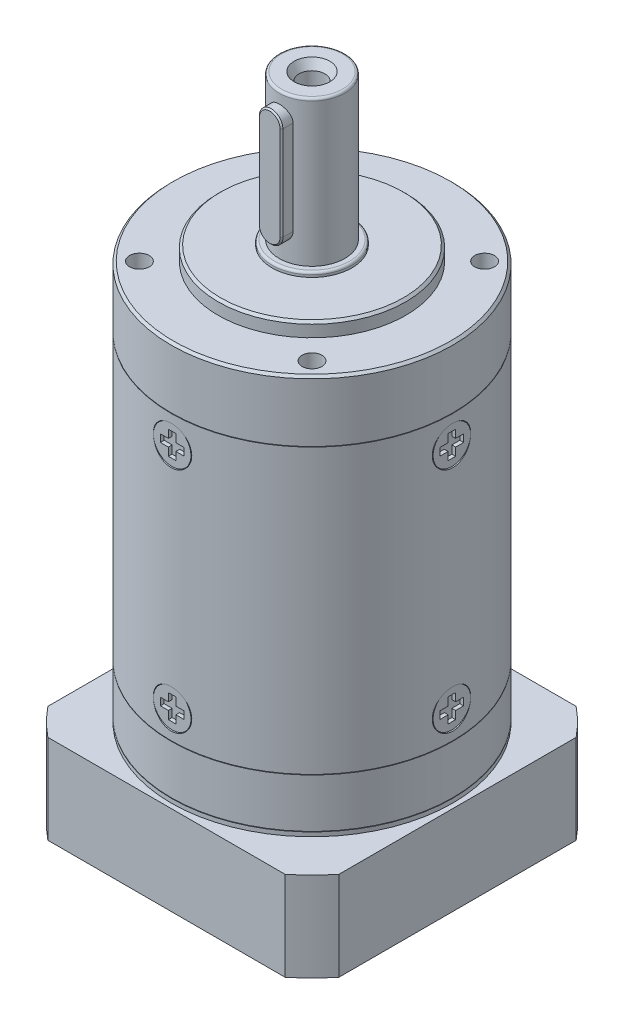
SolidWorks part; units mm, degrees
ref_plane "前视基准面" through (0, 0, 0) normal (0, 0, 1) x (1, 0, 0)
ref_plane "上视基准面" through (0, 0, 0) normal (0, 1, 0) x (1, 0, 0)
ref_plane "右视基准面" through (0, 0, 0) normal (1, 0, 0) x (0, 0, -1)
sketch "草图1" plane through (0, 0, 0) normal (0, 1, 0) x (1, 0, 0)
  circle A0 centre (0, 0) radius 20
extrude "凸台-拉伸1" add sketch "草图1" along normal blind 3
sketch "草图2" plane through (0, 0, 0) normal (0, -1, 0) x (1, 0, 0)
  circle A0 centre (0, 0) radius 30
extrude "凸台-拉伸2" add sketch "草图2" along normal blind 13
ref_plane "基准面1" through (0, -13.1, 0) normal (0, -1, 0) x (1, 0, 0)
sketch "草图3" plane through (0, -13.1, 0) normal (0, -1, 0) x (1, 0, 0)
  circle A0 centre (0, 0) radius 30
extrude "凸台-拉伸3" add sketch "草图3" along normal blind 60.4 separate body
ref_plane "基准面2" through (0, -73.6, 0) normal (0, -1, 0) x (1, 0, 0)
sketch "草图4" plane through (0, -73.6, 0) normal (0, -1, 0) x (1, 0, 0)
  circle A0 centre (0, 0) radius 30
extrude "凸台-拉伸4" add sketch "草图4" along normal blind 10.4 separate body
ref_plane "基准面3" through (0, -84.1, 0) normal (0, -1, 0) x (1, 0, 0)
sketch "草图5" plane through (0, -84.1, 0) normal (0, -1, 0) x (1, 0, 0)
  circle A0 centre (0, 0) radius 30
extrude "凸台-拉伸5" add sketch "草图5" along normal blind 0.9 separate body
sketch "草图6" plane through (0, -85, 0) normal (0, -1, 0) x (1, 0, 0)
  line L1 (-25.2784, 31) -> (25.2784, 31)
  line L2 (-31, 25.2784) -> (-31, -25.2784)
  line L3 (-25.2784, -31) -> (25.2784, -31)
  line L4 (31, 25.2784) -> (31, -25.2784)
  arc A0 (-25.2784, 31) -> (-31, 25.2784) centre (0, 0) ccw
  arc A1 (-31, -25.2784) -> (-25.2784, -31) centre (0, 0) ccw
  arc A2 (25.2784, -31) -> (31, -25.2784) centre (0, 0) ccw
  arc A3 (31, 25.2784) -> (25.2784, 31) centre (0, 0) ccw
  dimension "D1" = 31
  dimension "D3" = 31
extrude "凸台-拉伸6" add sketch "草图6" along normal blind 19
sketch "草图7" plane through (0, -104, 0) normal (0, -1, 0) x (1, 0, 0)
  circle A0 centre (0, 0) radius 25
extrude "切除-拉伸1" cut sketch "草图7" against normal blind 5
sketch "草图8" plane through (0, -99, 0) normal (0, -1, 0) x (1, 0, 0)
  circle A0 centre (0, 0) radius 17.5
extrude "切除-拉伸2" cut sketch "草图8" against normal blind 19
ref_plane "基准面4" through (0, -97, 0) normal (0, -1, 0) x (1, 0, 0)
sketch "草图9" plane through (0, -97, 0) normal (0, -1, 0) x (1, 0, 0)
  circle A0 centre (0, 0) radius 16
extrude "凸台-拉伸7" add sketch "草图9" against normal up to surface (17 mm away)
chamfer "倒角1" distance 1 angle 45 1 edges at (0, -97, -16)
sketch "草图10" plane through (0, -104, 0) normal (0, -1, 0) x (1, 0, 0)
  circle A0 centre (0, 0) radius 7
extrude "切除-拉伸3" cut sketch "草图10" against normal blind 32
sketch "草图11" plane through (0, -97, 0) normal (0, -1, 0) x (1, 0, 0)
  line L1 (-16.7216, 0.5) -> (16.9728, 0.5)
  line L2 (-16.7216, 0.5) -> (-16.7216, -0.5)
  line L3 (-16.7216, -0.5) -> (16.9728, -0.5)
  line L4 (16.9728, 0.5) -> (16.9728, -0.5)
  dimension "D1" = 0.5
  dimension "D2" = 1
extrude "切除-拉伸4" cut sketch "草图11" against normal up to surface (17 mm away)
sketch "草图12" plane through (0, -104, 0) normal (0, -1, 0) x (1, 0, 0)
  line L0 (0, 0) -> (0, 25.5) construction
  line L1 (0, 0) -> (-12.75, 22.0836) construction
  circle A0 centre (0, 0) radius 25.5 construction
  circle A1 centre (-12.75, 22.0836) radius 4
  dimension "D1" = 30
extrude "切除-拉伸5" cut sketch "草图12" against normal blind 12
pattern_circular "阵列(圆周)1" count 4 over 360 about axis through (0, 0, 0) along (0, 1, 0) of "切除-拉伸5"
chamfer "倒角3" distance 0.5 angle 45 1 edges at (0, 3, 20)
sketch "草图13" plane through (0, -104, 0) normal (0, -1, 0) x (1, 0, 0)
  line L0 (0, 0) -> (-24.7487, -24.7487)
  circle A0 centre (0, 0) radius 35
hole_wizard "M4 螺纹孔1" positions "3D草图1" profile "草图14" tap size "M4" standard "GB"
sketch3d "3D草图1"
  point P0 (-24.7487, -104, -24.7487)
sketch "草图14" plane through (-24.7487, -104, -24.7487) normal (1, 0, 0) x (0, 0, -1)
  line L0 (0, 0) -> (0, 14.4914)
  line L1 (0, 14.4914) -> (1.65, 13.5)
  line L2 (1.65, 13.5) -> (1.65, 0)
  line L5 (1.65, 0) -> (0, 0)
  line L10 (0, 14.4914) -> (-1.65, 13.5) construction
  line L11 (0, -6.35) -> (0, 107.95) construction
  dimension "螺纹孔钻头直径" = 3.3
  dimension "螺纹孔钻头深度" = 13.5
  dimension "导头角度" = 118
pattern_circular "阵列(圆周)2" count 4 over 360 about axis through (0, 0, 0) along (0, 1, 0) of "M4 螺纹孔1"
sketch "草图15" plane through (0, 3, 0) normal (0, 1, 0) x (1, 0, 0)
  circle A0 centre (0, 0) radius 8.5
extrude "凸台-拉伸8" add sketch "草图15" along normal blind 1
sketch "草图16" plane through (0, 4, 0) normal (0, 1, 0) x (1, 0, 0)
  circle A0 centre (0, 0) radius 7
extrude "凸台-拉伸9" add sketch "草图16" along normal blind 31
fillet "圆角1" radius 0.5 1 edges at (0, 4, 8.5)
fillet "圆角2" radius 0.5 1 edges at (0, 35, 7)
ref_plane "基准面5" through (0, 0, 30) normal (0, 0, 1) x (1, 0, 0)
ref_plane "基准面6" through (0, 0, 29) normal (0, 0, 1) x (1, 0, 0)
sketch "草图19" plane through (0, 0, 29) normal (0, 0, 1) x (1, 0, 0)
  line L0 (-30, -13) -> (30, -13) construction
  line L1 (30, -73.6) -> (-30, -73.6) construction
  circle A0 centre (0, -19) radius 4.1
  circle A1 centre (0, -67.6) radius 4.1
  dimension "D1" = 6
  dimension "D2" = 6
extrude "切除-拉伸6" cut sketch "草图19" along normal blind 31
pattern_circular "阵列(圆周)5" count 4 over 360 about axis through (0, 0, 0) along (0, 1, 0) of "切除-拉伸6"
sketch "草图20" plane through (0, 0, 29) normal (0, 0, 1) x (1, 0, 0)
  line L0 (0.8, -19.8) -> (0.8, -21.5)
  line L1 (-0.8, -16.5) -> (0.8, -16.5)
  line L2 (-0.8, -16.5) -> (-0.8, -18.2)
  line L3 (-0.8, -21.5) -> (0.8, -21.5)
  line L4 (0.8, -16.5) -> (0.8, -18.2)
  line L5 (-2.5, -18.2) -> (-0.8, -18.2)
  line L6 (-2.5, -18.2) -> (-2.5, -19.8)
  line L7 (-2.5, -19.8) -> (-0.8, -19.8)
  line L8 (2.5, -18.2) -> (2.5, -19.8)
  line L9 (-0.8, -19.8) -> (-0.8, -21.5)
  line L10 (0.8, -18.2) -> (2.5, -18.2)
  line L11 (0.8, -19.8) -> (2.5, -19.8)
  line L12 (0.8, -68.4) -> (0.8, -70.1)
  line L13 (-2.5, -66.8) -> (-0.8, -66.8)
  line L14 (-2.5, -66.8) -> (-2.5, -68.4)
  line L15 (-2.5, -68.4) -> (-0.8, -68.4)
  line L16 (2.5, -66.8) -> (2.5, -68.4)
  line L17 (-0.8, -65.1) -> (0.8, -65.1)
  line L18 (-0.8, -65.1) -> (-0.8, -66.8)
  line L19 (-0.8, -70.1) -> (0.8, -70.1)
  line L20 (0.8, -65.1) -> (0.8, -66.8)
  line L21 (-0.8, -68.4) -> (-0.8, -70.1)
  line L22 (0.8, -66.8) -> (2.5, -66.8)
  line L23 (0.8, -68.4) -> (2.5, -68.4)
  circle A0 centre (0, -19) radius 4
  circle A1 centre (0, -67.6) radius 4
  dimension "D1" = 0.8
  dimension "D9" = 0.8
  dimension "D2" = 1.6
  dimension "D3" = 0.8
  dimension "D4" = 1.6
  dimension "D5" = 2.5
  dimension "D6" = 5
  dimension "D7" = 2.5
  dimension "D8" = 5
  dimension "D10" = 1.6
  dimension "D11" = 0.8
  dimension "D12" = 1.6
  dimension "D13" = 2.5
  dimension "D14" = 5
  dimension "D15" = 2.5
  dimension "D16" = 5
extrude "凸台-拉伸10" add sketch "草图20" along normal blind 0.8
pattern_circular "阵列(圆周)21" count 4 over 360 about axis through (0, 0, 0) along (0, 1, 0) of "凸台-拉伸10"
sketch "草图21" plane through (0, -92, 0) normal (0, -1, 0) x (1, 0, 0)
  line L1 (-11.8663, 23.5733) -> (-13.5983, 23.5938)
  line L2 (-13.5983, 23.5938) -> (-14.4819, 22.1041)
  line L3 (-14.4819, 22.1041) -> (-13.6337, 20.594)
  line L4 (-13.6337, 20.594) -> (-11.9017, 20.5735)
  line L5 (-11.9017, 20.5735) -> (-11.0181, 22.0632)
  line L6 (-11.0181, 22.0632) -> (-11.8663, 23.5733)
  circle A0 centre (-12.75, 22.0836) radius 3.5
  circle A1 centre (-12.75, 22.0836) radius 1.5 construction
  dimension "D1" = 3
extrude "凸台-拉伸11" add sketch "草图21" along normal blind 4
pattern_circular "阵列(圆周)22" count 4 over 360 about axis through (0, 0, 0) along (0, 1, 0) of "凸台-拉伸11"
sketch "草图22" plane through (0, 0, 0) normal (0, 0, 1) x (1, 0, 0)
  line L0 (6.5, 35) -> (-6.5, 35) construction
  line L1 (-2.5, 30) -> (-2.5, 10)
  line L2 (2.5, 30) -> (2.5, 10)
  arc A0 (2.5, 30) -> (-2.5, 30) centre (0, 30) ccw
  arc A1 (-2.5, 10) -> (2.5, 10) centre (0, 10) ccw
  dimension "D1" = 5
  dimension "D2" = 20
extrude "凸台-拉伸12" add sketch "草图22" along normal blind 9
chamfer "倒角4" distance 0.3 angle 45 4 edges at (-2.5, 20, 9) (0, 7.5, 9) (0, 32.5, 9) (2.5, 20, 9)
chamfer "倒角5" distance 0.5 angle 45 1 edges at (0, 0, -30)
ref_plane "基准面7" through (0, 33.2, 0) normal (0, 1, 0) x (-1, 0, 0)
sketch "草图25" plane through (0, 35, 0) normal (0, 1, 0) x (1, 0, 0)
  circle A0 centre (0, 0) radius 2.75
extrude "切除-拉伸7" cut sketch "草图25" against normal blind 4.8
sketch "草图26" plane through (0, 33.2, 0) normal (0, 1, 0) x (-1, 0, 0)
  circle A0 centre (0, 0) radius 2.75
sketch "草图28" plane through (0, 35, 0) normal (0, 1, 0) x (1, 0, 0)
  circle A0 centre (0, 0) radius 3.8
loft "切除-放样1" cut profiles "草图26", "草图28"
hole_wizard "M5 螺纹孔1" positions "3D草图2" profile "草图29" tap size "M5" standard "GB"
sketch3d "3D草图2"
  line L0 (0, 30.2, 0) -> (0, 33.2, 0) construction
  point P0 (0, 30.2, 0)
sketch "草图29" plane through (0, 30.2, 0) normal (1, 0, 0) x (0, 0, 1)
  line L0 (0, 0) -> (0, 12.9618)
  line L1 (0, 12.9618) -> (2.1, 11.7)
  line L2 (2.1, 11.7) -> (2.1, 0)
  line L5 (2.1, 0) -> (0, 0)
  line L10 (0, 12.9618) -> (-2.1, 11.7) construction
  line L11 (0, -6.35) -> (0, 107.95) construction
  dimension "螺纹孔钻头直径" = 4.2
  dimension "螺纹孔钻头深度" = 11.7
  dimension "导头角度" = 118
sketch "草图30" plane through (0, 0, 0) normal (0, 1, 0) x (1, 0, 0)
  line L0 (0, 0) -> (0, 26)
  line L1 (0, 0) -> (-18.3848, 18.3848)
  circle A0 centre (0, 0) radius 26
hole_wizard "M5 螺纹孔2" positions "3D草图3" profile "草图31" tap size "M5" standard "GB"
sketch3d "3D草图3"
  point P0 (-18.3848, 0, -18.3848)
sketch "草图31" plane through (-18.3848, 0, -18.3848) normal (1, 0, 0) x (0, 0, 1)
  line L0 (0, 0) -> (0, 17.2618)
  line L1 (0, 17.2618) -> (2.1, 16)
  line L2 (2.1, 16) -> (2.1, 0)
  line L5 (2.1, 0) -> (0, 0)
  line L10 (0, 17.2618) -> (-2.1, 16) construction
  line L11 (0, -6.35) -> (0, 107.95) construction
  dimension "螺纹孔钻头直径" = 4.2
  dimension "螺纹孔钻头深度" = 16
  dimension "导头角度" = 118
pattern_circular "阵列(圆周)23" count 4 over 360 about axis through (0, 0, 0) along (0, 1, 0) of "M5 螺纹孔2"
